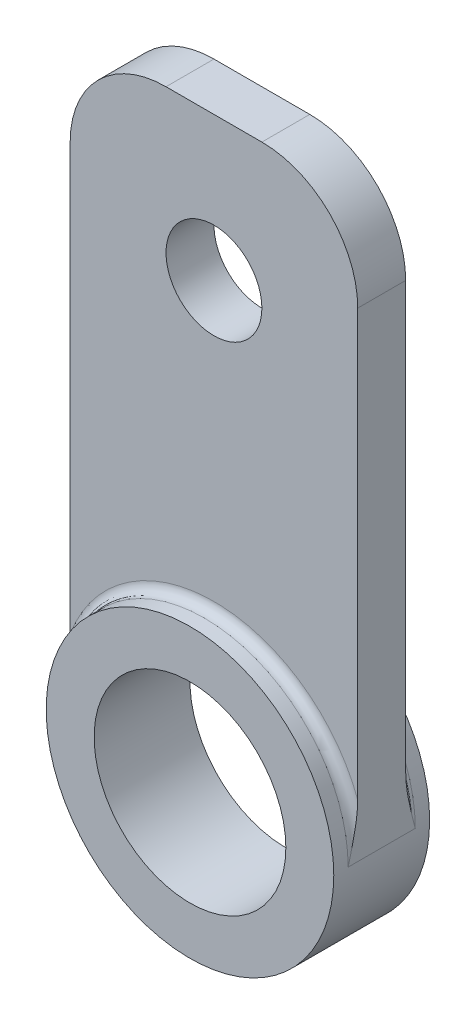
SolidWorks part; units mm, degrees
ref_plane "Front Plane" through (0, 0, 0) normal (0, 0, 1) x (1, 0, 0)
ref_plane "Top Plane" through (0, 0, 0) normal (0, 1, 0) x (1, 0, 0)
ref_plane "Right Plane" through (0, 0, 0) normal (1, 0, 0) x (0, 0, -1)
sketch "Sketch1" plane through (0, 0, 0) normal (0, 0, 1) x (1, 0, 0)
  circle A0 centre (0, 0) radius 10
  circle A1 centre (0, 0) radius 15
  dimension "D1" = 30
  dimension "D2" = 20
extrude "Boss-Extrude1" add sketch "Sketch1" along normal mid plane 10
sketch "Sketch2" plane through (0, 0, 0) normal (0, 0, 1) x (1, 0, 0)
  line L2 (-15, 0) -> (-15, 50)
  line L3 (-5, 60) -> (5, 60)
  line L4 (15, 0) -> (15, 50)
  circle A0 centre (0, 0) radius 15
  circle A1 centre (0, 45) radius 5
  arc A2 (5, 60) -> (15, 50) centre (5, 50) cw
  arc A3 (-15, 50) -> (-5, 60) centre (-5, 50) cw
  point P9 (0, 0)
  point P12 (15, 60)
  point P15 (-15, 60)
  point P16 (0, 0)
  dimension "D1" = 45
  dimension "D3" = 10
  dimension "D4" = 10
  dimension "D5" = 15
  dimension "D2" = 30
  dimension "D6" = 60
extrude "Boss-Extrude2" add sketch "Sketch2" along normal mid plane 5 contours A3 L2 A0 L4 A2 L3 A1
fillet "Fillet1" radius 1 2 edges at (0, 15, -2.5) (0, 15, 2.5)
